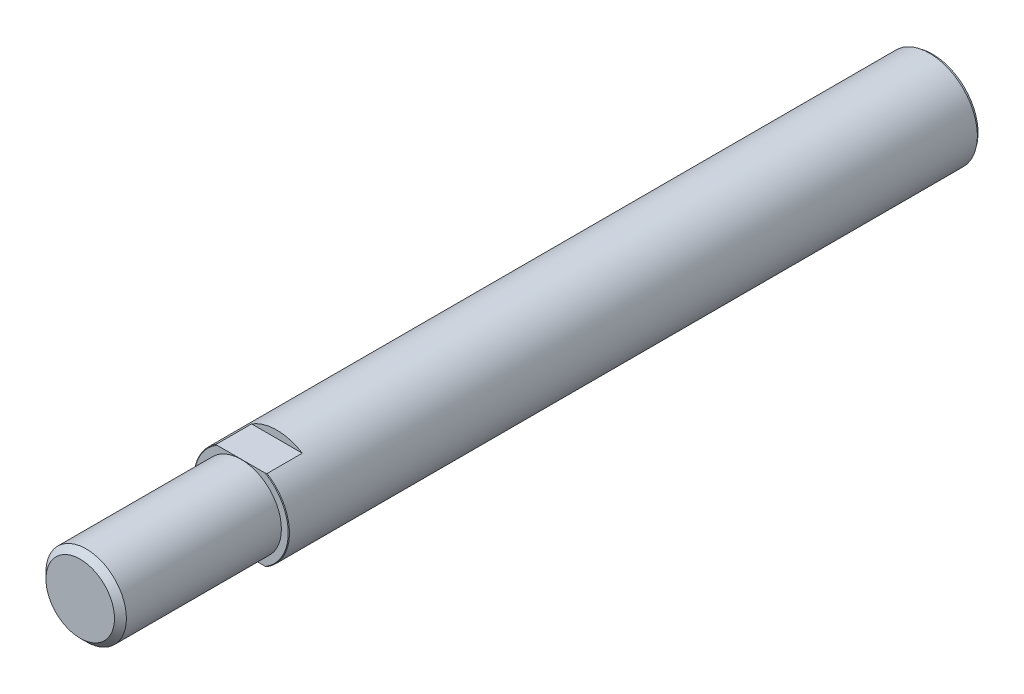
SolidWorks part; units mm, degrees
ref_plane "Plano frontal" through (0, 0, 0) normal (0, 0, 1) x (1, 0, 0)
ref_plane "Plano superior" through (0, 0, 0) normal (0, 1, 0) x (1, 0, 0)
ref_plane "Plano direito" through (0, 0, 0) normal (1, 0, 0) x (0, 0, -1)
sketch "Esboço1" plane through (0, 0, 0) normal (0, 0, 1) x (1, 0, 0)
  circle A0 centre (0, 0) radius 16
  dimension "D1" = 32
extrude "Ressalto-extrusão1" add sketch "Esboço1" along normal blind 286
sketch "Esboço2" plane through (0, 0, 286) normal (0, 0, 1) x (1, 0, 0)
  circle A0 centre (0, 0) radius 13.5
  dimension "D1" = 27
extrude "Corte-extrusão1" cut sketch "Esboço2" against normal blind 54 flip side to cut
chamfer "Chanfro1" distance 0.2 angle 45 1 edges at (16, 0, 232)
chamfer "Chanfro2" distance 2 angle 45 1 edges at (13.5, 0, 286)
sketch "Esboço3" plane through (0, 0, 232) normal (0, 0, 1) x (1, 0, 0)
  line L1 (-21.7985, -13.55) -> (21.7985, -13.55)
  line L2 (-21.7985, -13.55) -> (-21.7985, 13.55)
  line L3 (-21.7985, 13.55) -> (21.7985, 13.55)
  line L4 (21.7985, -13.55) -> (21.7985, 13.55)
  line L5 (-21.7985, -13.55) -> (21.7985, 13.55) construction
  line L6 (-21.7985, 13.55) -> (21.7985, -13.55) construction
  point P0 (0, 0)
  dimension "D1" = 27.1
extrude "Corte-extrusão2" cut sketch "Esboço3" against normal blind 12 flip side to cut
sketch "Esboço4" plane through (0, 0, 0) normal (0, 0, -1) x (-1, 0, 0)
  circle A0 centre (0, 0) radius 15.25
  dimension "D1" = 30.5
extrude "Corte-extrusão3" cut sketch "Esboço4" against normal blind 1 flip side to cut
hole_wizard "Furo roscado de M12x1.751" positions "Esboço5" profile "Esboço6" tap size "M12x1.75" standard "Ansi Metric"
sketch "Esboço5" plane through (0, 0, 0) normal (0, 0, -1) x (-1, 0, 0)
  point P0 (0, 0)
sketch "Esboço6" plane through (0, 0, 0) normal (1, 0, 0) x (0, 1, 0)
  line L0 (0, 0) -> (0, 35.8144)
  line L1 (0, 35.8144) -> (5.1, 32.75)
  line L2 (5.1, 32.75) -> (5.1, 0)
  line L5 (5.1, 0) -> (0, 0)
  line L10 (0, 35.8144) -> (-5.1, 32.75) construction
  line L11 (0, -6.35) -> (0, 107.95) construction
  dimension "Tap Drill Dia." = 10.2
  dimension "Tap Drill Depth" = 32.75
  dimension "Drill Angle" = 118
